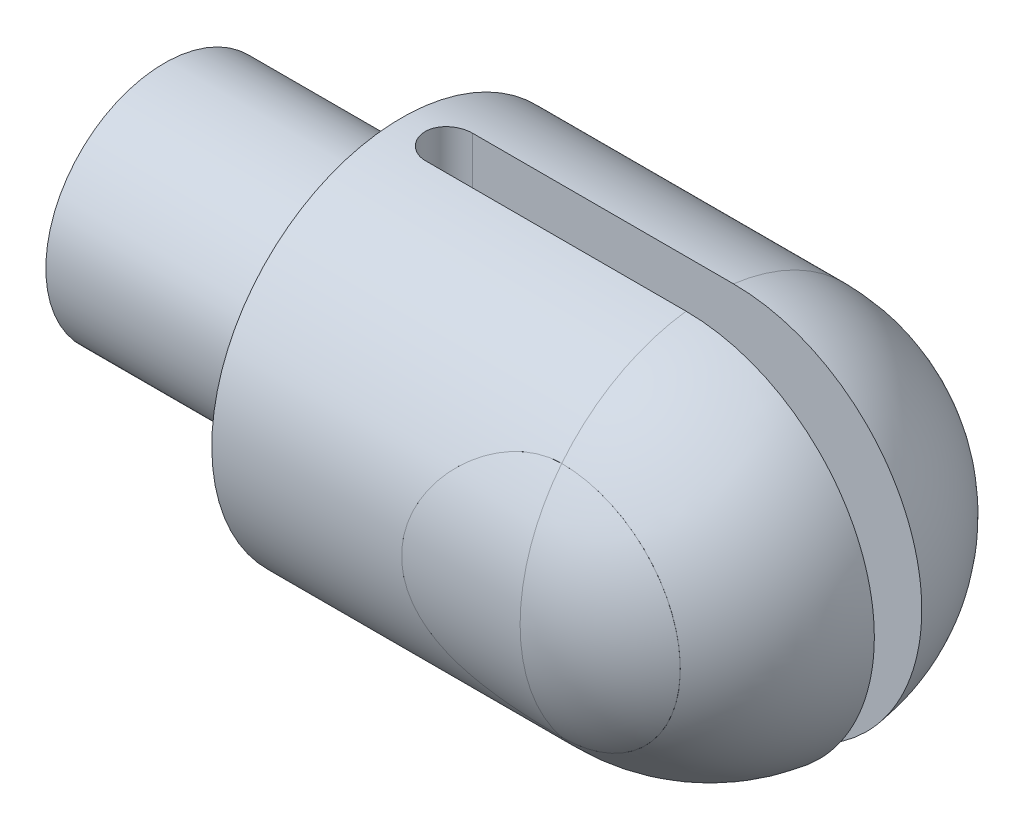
SolidWorks part; units mm, degrees
ref_plane "Спереди" through (0, 0, 0) normal (0, 0, 1) x (1, 0, 0)
ref_plane "Сверху" through (0, 0, 0) normal (0, 1, 0) x (1, 0, 0)
ref_plane "Справа" through (0, 0, 0) normal (1, 0, 0) x (0, 0, -1)
sketch "Эскиз3" plane through (0, 0, 0) normal (1, 0, 0) x (0, 0, -1)
  circle A0 centre (0, 0) radius 5
  dimension "D1" = 10
extrude "Бобышка-Вытянуть2" add sketch "Эскиз3" along normal blind 10
sketch "Эскиз4" plane through (10, 0, 0) normal (1, 0, 0) x (0, 0, -1)
  circle A0 centre (0, 0) radius 8
  dimension "D1" = 16
extrude "Бобышка-Вытянуть3" add sketch "Эскиз4" along normal blind 20.94
sketch "Эскиз5" plane through (0, 0, 0) normal (0, 1, 0) x (1, 0, 0)
  line L0 (12, 1) -> (30.94, 1)
  line L1 (30.94, -8) -> (30.94, 8) construction
  line L2 (12, -1) -> (30.94, -1)
  line L3 (30.94, 1) -> (30.94, -1)
  arc A0 (12, 1) -> (12, -1) centre (12, 0) ccw
  dimension "D1" = 2
  dimension "D2" = 18.94
extrude "Вырез-Вытянуть2" cut sketch "Эскиз5" against normal mid plane 20.94
sketch "Эскиз6" plane through (0, 0, 0) normal (0, 0, 1) x (1, 0, 0)
  line L0 (30.94, 7.9373) -> (12, 7.9373) construction
  line L1 (30.94, -7.9373) -> (30.94, 7.9373) construction
  line L2 (12, -7.9373) -> (30.94, -7.9373) construction
  circle A0 centre (23.0027, 0) radius 7.9373 construction
  circle A1 centre (23.0027, 0) radius 5
  dimension "D1" = 10
extrude "Вырез-Вытянуть3" cut sketch "Эскиз6" against normal mid plane 20.94
sketch "Эскиз7" plane through (0, 0, 0) normal (0, 0, 1) x (1, 0, 0)
  circle A0 centre (23.0027, 0) radius 5 construction
  circle A1 centre (23.0027, 0) radius 5
extrude "Бобышка-Вытянуть4" add sketch "Эскиз7" along normal mid plane 20.94 separate body
sketch "Эскиз8" plane through (0, 0, 0) normal (0, 0, 1) x (1, 0, 0)
  line L3 (0, 0) -> (23.0027, 0) construction
  line L4 (31.0027, 0) -> (36.0027, 0)
  line L5 (10, 8) -> (10, -8) construction
  line L6 (10, 13) -> (36.0027, 13)
  line L8 (36.0027, 0) -> (36.0027, 13)
  line L10 (10, 13) -> (10, 8)
  line L11 (10, 8) -> (23.0027, 8)
  arc A0 (31.0027, 0) -> (23.0027, 8) centre (23.0027, 0) ccw
  dimension "D1" = 16
  dimension "D2" = 5
  dimension "D3" = 5
revolve "Вырез-Повернуть7" cut sketch "Эскиз8" angle 360 about L3
